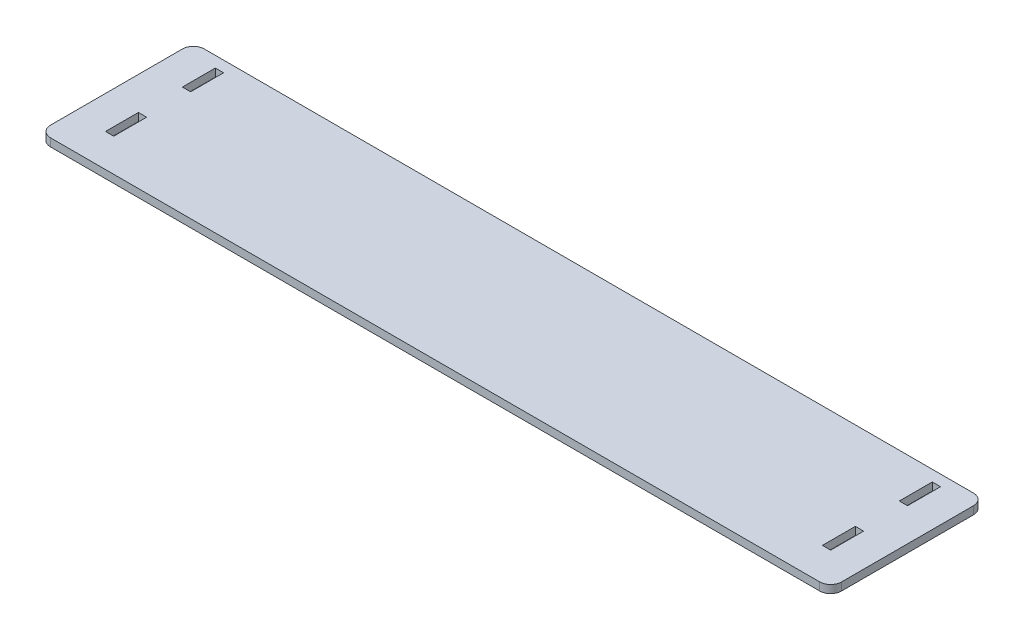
SolidWorks part; units mm, degrees
ref_plane "Front Plane" through (0, 0, 0) normal (0, 0, 1) x (1, 0, 0)
ref_plane "Top Plane" through (0, 0, 0) normal (0, 1, 0) x (1, 0, 0)
ref_plane "Right Plane" through (0, 0, 0) normal (1, 0, 0) x (0, 0, -1)
sketch "Sketch1" plane through (0, 0, 0) normal (0, 1, 0) x (1, 0, 0)
  line L1 (914.4, -177.8) -> (-914.4, -177.8)
  line L2 (914.4, -177.8) -> (914.4, 177.8)
  line L3 (914.4, 177.8) -> (-914.4, 177.8)
  line L4 (-914.4, -177.8) -> (-914.4, 177.8)
  line L5 (914.4, -177.8) -> (-914.4, 177.8) construction
  line L6 (914.4, 177.8) -> (-914.4, -177.8) construction
  point P0 (0, 0)
  dimension "D1" = 1828.8
  dimension "D2" = 355.6
extrude "Boss-Extrude1" add sketch "Sketch1" along normal blind 18.288
fillet "Fillet1" radius 25.4 4 edges at (-914.4, 9.144, -177.8) (-914.4, 9.144, 177.8) (914.4, 9.144, -177.8) (914.4, 9.144, 177.8)
sketch "Sketch2" plane through (0, 18.288, 0) normal (0, 1, 0) x (1, 0, 0)
  line L0 (-889, -177.8) -> (889, -177.8) construction
  line L1 (-838.2, 152.4) -> (-819.15, 152.4)
  line L2 (-838.2, 152.4) -> (-838.2, 76.2)
  line L3 (-838.2, 76.2) -> (-819.15, 76.2)
  line L4 (-819.15, 152.4) -> (-819.15, 76.2)
  line L5 (-838.2, -25.4) -> (-819.15, -25.4)
  line L6 (-838.2, -25.4) -> (-838.2, -101.6)
  line L7 (-838.2, -101.6) -> (-819.15, -101.6)
  line L8 (-819.15, -25.4) -> (-819.15, -101.6)
  line L9 (889, 177.8) -> (-889, 177.8) construction
  line L10 (-914.4, 152.4) -> (-914.4, -152.4) construction
  dimension "D1" = 76.2
  dimension "D2" = 25.4
  dimension "D3" = 76.2
  dimension "D4" = 76.2
  dimension "D5" = 19.05
extrude "Cut-Extrude1" cut sketch "Sketch2" against normal through all
mirror "Mirror1" about plane through (0, 0, 0) normal (1, 0, 0) of "Cut-Extrude1"
